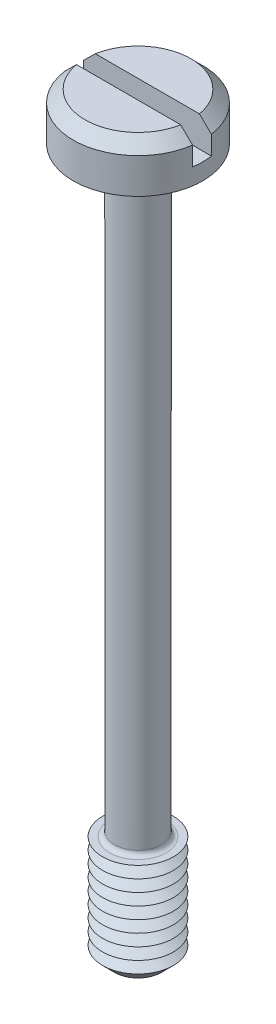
SolidWorks part; units mm, degrees
ref_plane "Front Plane" through (0, 0, 0) normal (0, 0, 1) x (1, 0, 0)
ref_plane "Top Plane" through (0, 0, 0) normal (0, 1, 0) x (1, 0, 0)
ref_plane "Right Plane" through (0, 0, 0) normal (1, 0, 0) x (0, 0, -1)
sketch "Sketch1" plane through (0, 0, 0) normal (0, 1, 0) x (1, 0, 0)
  circle A0 centre (0, 0) radius 2.75
  dimension "D1" = 5.5
extrude "Boss-Extrude1" add sketch "Sketch1" along normal blind 2
sketch "Sketch2" plane through (0, 0, 0) normal (0, -1, 0) x (1, 0, 0)
  circle A0 centre (0, 0) radius 1
  dimension "D1" = 2
extrude "Boss-Extrude2" add sketch "Sketch2" along normal blind 30
sketch "Sketch3" plane through (0, -30, 0) normal (0, -1, 0) x (1, 0, 0)
  circle A0 centre (0, 0) radius 1.5
  dimension "D1" = 3
extrude "Boss-Extrude3" add sketch "Sketch3" against normal blind 4.5
chamfer "Chamfer1" distance 0.5 angle 45 1 edges at (0, -30, -1.5)
sketch "Sketch4" plane through (0, 0, 0) normal (1, 0, 0) x (0, 0, -1)
  line L0 (0, -6.5871) -> (0, -12.0372) construction
sketch "Sketch5" plane through (0, 0, 0) normal (1, 0, 0) x (0, 0, -1)
  line L0 (-1.5, -25.5) -> (-1.067, -25.75)
  line L1 (-1.067, -25.75) -> (-1.5, -26)
  line L2 (-1.5, -25.5) -> (-1.5, -29.5) construction
  line L3 (-1.5, -26) -> (-1.5, -25.5)
  dimension "D1" = 0.5
revolve "Cut-Revolve1" cut sketch "Sketch5" angle 360 about L0
pattern_linear "LPattern1" count 8 spacing 0.5 along (0, -1, 0) of "Cut-Revolve1"
fillet "Fillet1" radius 0.2 2 edges at (0, -25.5, -1) (0, 0, -1)
chamfer "Chamfer2" distance 0.5 angle 45 1 edges at (0, 2, 2.75)
sketch "Sketch6" plane through (0, 2, 0) normal (0, 1, 0) x (1, 0, 0)
  line L1 (2.75, -0.4) -> (-2.75, -0.4)
  line L2 (2.75, -0.4) -> (2.75, 0.4)
  line L3 (2.75, 0.4) -> (-2.75, 0.4)
  line L4 (-2.75, -0.4) -> (-2.75, 0.4)
  line L5 (2.75, -0.4) -> (-2.75, 0.4) construction
  line L6 (2.75, 0.4) -> (-2.75, -0.4) construction
  circle A0 centre (0, 0) radius 2.75 construction
  point P0 (0, 0)
  dimension "D1" = 0.8
extrude "Cut-Extrude1" cut sketch "Sketch6" against normal blind 1.3
